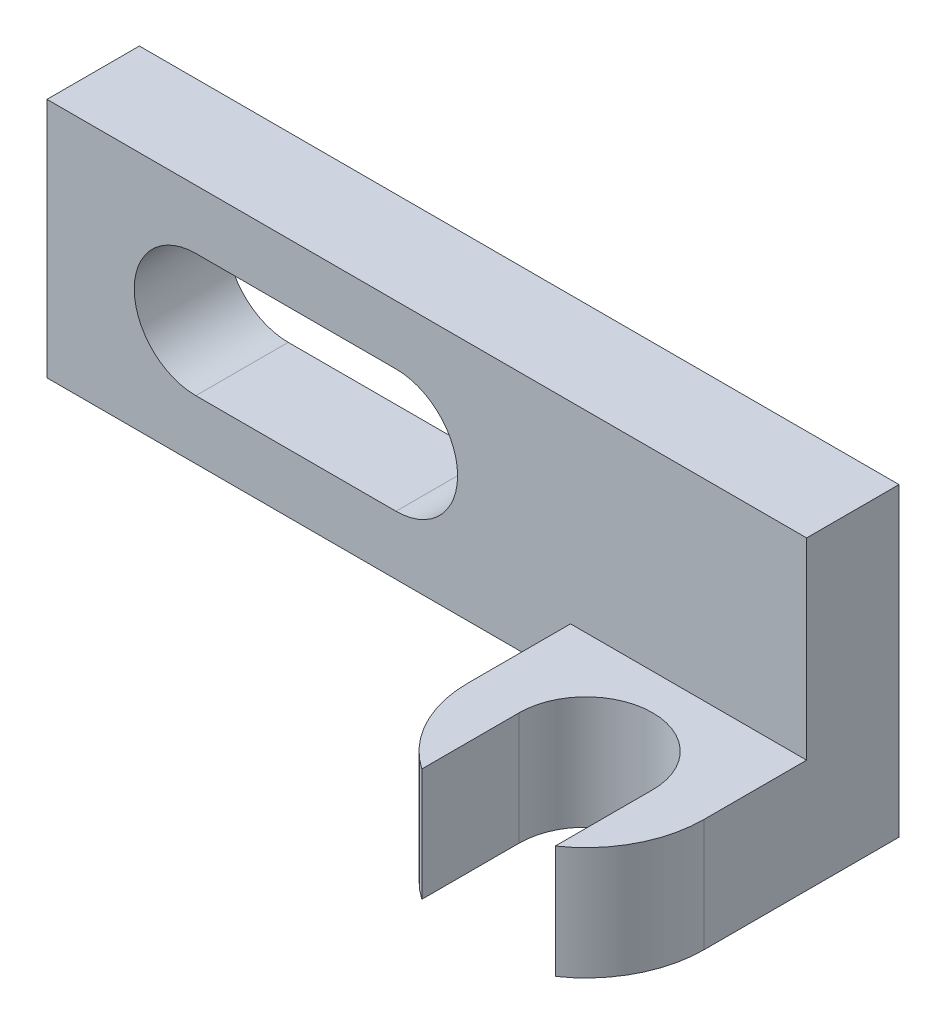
SolidWorks part; units mm, degrees
ref_plane "前视基准面" through (0, 0, 0) normal (0, 0, 1) x (1, 0, 0)
ref_plane "上视基准面" through (0, 0, 0) normal (0, 1, 0) x (1, 0, 0)
ref_plane "右视基准面" through (0, 0, 0) normal (1, 0, 0) x (0, 0, -1)
sketch "草图1" plane through (0, 0, 0) normal (0, 0, 1) x (1, 0, 0)
  line L0 (0, 0) -> (-45.1884, 0) construction
  line L1 (-58, 47) -> (238, 47)
  line L2 (-58, 47) -> (-58, -47)
  line L3 (-58, -47) -> (238, -47)
  line L4 (238, 47) -> (238, -47)
  line L5 (0, 24) -> (78, 24)
  line L6 (78, -24) -> (0, -24)
  arc A0 (78, 24) -> (78, -24) centre (78, 0) cw
  arc A1 (0, -24) -> (0, 24) centre (0, 0) cw
  dimension "D1" = 296
  dimension "D2" = 58
  dimension "D3" = 94
  dimension "D4" = 48
  dimension "D5" = 78
extrude "拉伸1" add sketch "草图1" along normal blind 36
ref_plane "基准面1" through (0, -28, 0) normal (0, 1, 0) x (-1, 0, 0)
sketch "草图2" plane through (0, -28, 0) normal (0, 1, 0) x (-1, 0, 0)
  line L1 (-238, 36) -> (58, 36) construction
  line L7 (-238, 0) -> (58, 0) construction
  line L8 (-146, 0) -> (-146, 76)
  line L9 (-238, 76) -> (-238, 0)
  line L10 (-238, 0) -> (-146, 0)
  line L11 (-166, 113.9473) -> (-166, 76)
  line L12 (-218, 76) -> (-218, 113.9473)
  arc A3 (-146, 76) -> (-166, 113.9473) centre (-192, 76) ccw
  arc A4 (-166, 76) -> (-218, 76) centre (-192, 76) cw
  arc A5 (-218, 113.9473) -> (-238, 76) centre (-192, 76) ccw
  dimension "D4" = 52
  dimension "D5" = 40
  dimension "D6" = 92
extrude "拉伸2" add sketch "草图2" against normal blind 44
